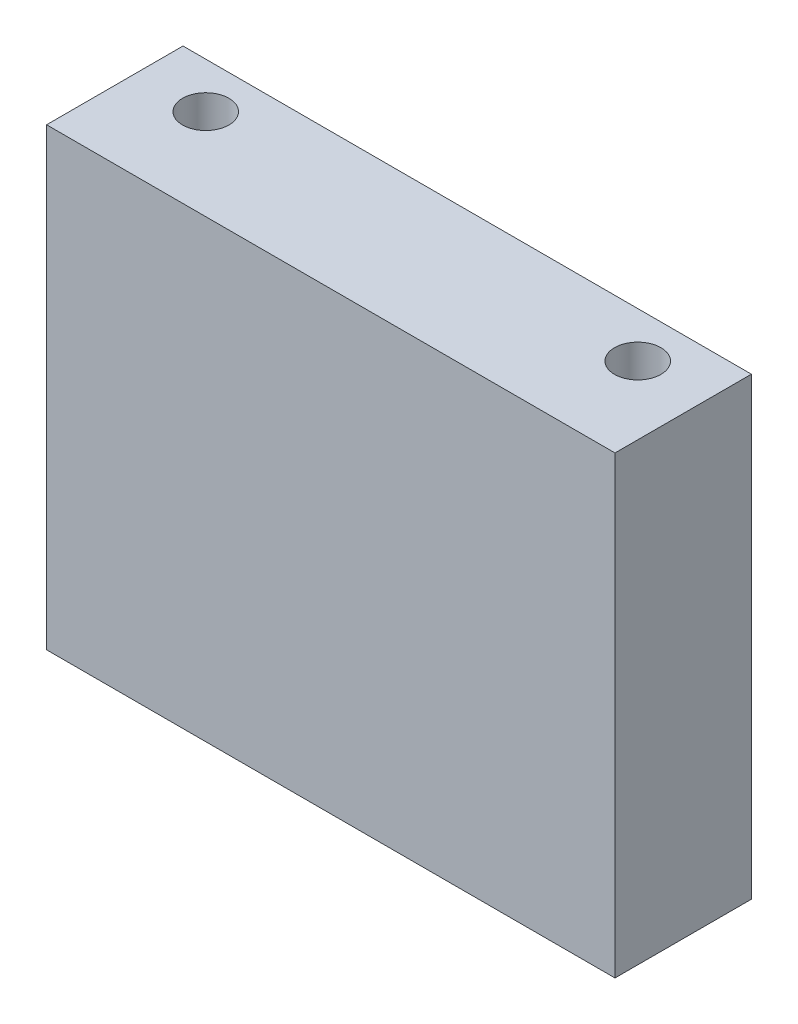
SolidWorks part; units mm, degrees
ref_plane "Frontal" through (0, 0, 0) normal (0, 0, 1) x (1, 0, 0)
ref_plane "Horizontal" through (0, 0, 0) normal (0, 1, 0) x (1, 0, 0)
ref_plane "Vertical" through (0, 0, 0) normal (1, 0, 0) x (0, 0, -1)
imported_body "Importée1"
sketch "Esquisse1" plane through (0, 0, 0) normal (0, 0, -1) x (-1, 0, 0)
  line L0 (50, 40) -> (-50, 40) construction
  arc A0 (30, 20) -> (30, 60) centre (30, 40) ccw construction
  arc A1 (-30, 60) -> (-30, 20) centre (-30, 40) ccw construction
sketch "Esquisse2" plane through (0, 0, 30) normal (0, 0, 1) x (1, 0, 0)
  line L1 (-62.5, 0) -> (31.1025, 0)
  line L2 (-62.5, 0) -> (-62.5, 46.9205)
  line L3 (-62.5, 46.9205) -> (31.1025, 46.9205)
  line L4 (31.1025, 0) -> (31.1025, 46.9205)
extrude "Extrusion1" [suppressed] cut sketch "Esquisse2" against normal through all
other "SupprimerFace1"
hole_wizard "Trou taraudé M121" positions "Esquisse5" profile "Esquisse4" tap size "M12" standard "ISO"
sketch "Esquisse5" plane through (0, 100, 0) normal (0, 1, 0) x (-1, 0, 0)
  line L0 (0, -10.0822) -> (0, 47.5871) construction
  line L1 (-62.5, 0) -> (62.5, 0) construction
  point P0 (47.5, 10)
  point P5 (-47.5, 10)
  dimension "D1" = 95
  dimension "D2" = 10
sketch "Esquisse4" plane through (-47.5, 100, 10) normal (1, 0, 0) x (0, 0, 1)
  line L0 (0, 0) -> (0, 35.8144)
  line L1 (0, 35.8144) -> (5.1, 32.75)
  line L2 (5.1, 32.75) -> (5.1, 0)
  line L5 (5.1, 0) -> (0, 0)
  line L10 (0, 35.8144) -> (-5.1, 32.75) construction
  line L11 (0, -6.35) -> (0, 107.95) construction
  dimension "Diamètre du trou pour taraudage" = 10.2
  dimension "Profondeur du trou pour taraudage" = 32.75
  dimension "Angle de pointe" = 118
other "SupprimerFace2" [suppressed]
